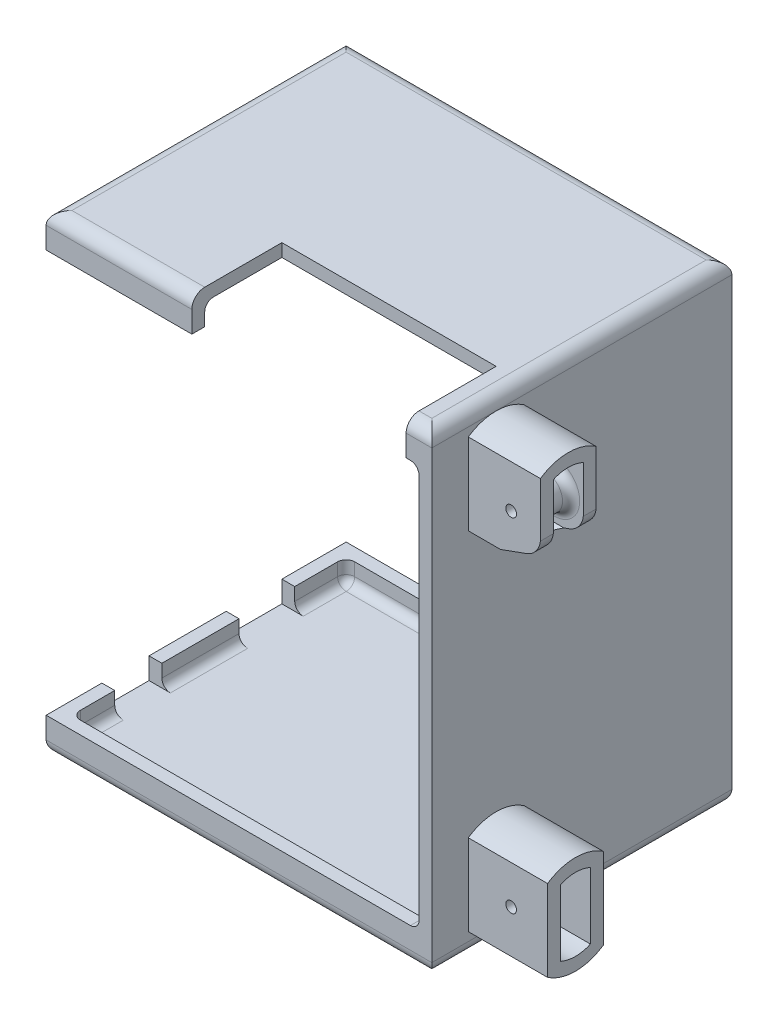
SolidWorks part; units mm, degrees
ref_plane "Plan de face" through (0, 0, 0) normal (0, 0, 1) x (1, 0, 0)
ref_plane "Plan de dessus" through (0, 0, 0) normal (0, 1, 0) x (1, 0, 0)
ref_plane "Plan de droite" through (0, 0, 0) normal (1, 0, 0) x (0, 0, -1)
sketch "Esquisse1" plane through (0, 0, 0) normal (0, 0, 1) x (1, 0, 0)
  line L0 (-3, 107) -> (-87, 107)
  line L1 (0, 0) -> (-90, 0)
  line L2 (0, 0) -> (0, 110)
  line L3 (0, 110) -> (-90, 110)
  line L4 (-90, 0) -> (-90, 20)
  line L5 (-87, 3) -> (-87, 20)
  line L6 (-3, 3) -> (-87, 3)
  line L7 (-3, 3) -> (-3, 107)
  line L8 (-90, 90) -> (-87, 90)
  line L9 (-90, 20) -> (-87, 20)
  line L10 (-87, 90) -> (-87, 107)
  line L11 (-90, 90) -> (-90, 110)
  line L12 (-87, 3) -> (-87, 107) construction
  line L14 (-90, 0) -> (-90, 110) construction
  dimension "D1" = 90
  dimension "D2" = 110
  dimension "D4" = 20
  dimension "D5" = 20
  dimension "D3" = 3
extrude "Boss.-Extru.2" add sketch "Esquisse1" along normal blind 70 contours L3 L11 L8 L10 L0 L7 L6 L5 L9 L4 L1 L2
ref_plane "Plan1" through (0, 0, 55) normal (0, 0, 1) x (1, 0, 0)
sketch "Esquisse6" plane through (-3, 0, 0) normal (-1, 0, 0) x (0, 0, 1)
  line L0 (0, 3) -> (0, 107) construction
  line L1 (70, 107) -> (67, 107)
  line L2 (70, 107) -> (70, 102)
  line L3 (70, 102) -> (67, 102)
  line L4 (67, 107) -> (67, 102)
  line L5 (0, 3) -> (3, 3)
  line L6 (0, 3) -> (0, 8)
  line L7 (0, 8) -> (3, 8)
  line L8 (3, 3) -> (3, 8)
  line L9 (70, 3) -> (0, 3) construction
  line L10 (70, 3) -> (70, 107) construction
  line L11 (0, 107) -> (3, 107)
  line L12 (0, 107) -> (0, 102)
  line L13 (0, 102) -> (3, 102)
  line L14 (3, 107) -> (3, 102)
  line L15 (70, 3) -> (67, 3)
  line L16 (70, 3) -> (70, 8)
  line L17 (70, 8) -> (67, 8)
  line L18 (67, 3) -> (67, 8)
  point P24 (1.5, 102)
  dimension "D1" = 3
  dimension "D3" = 3
  dimension "D4" = 5
extrude "Boss.-Extru.5" add sketch "Esquisse6" along normal up to next
fillet "Congé1" radius 3 8 edges at (-45, 110, 0) (-45, 110, 70) (-45, 0, 0) (-45, 0, 70) (-90, 0, 35) (-90, 110, 35) (0, 0, 35) (0, 110, 35)
sketch "Esquisse2" plane through (0, 0, 0) normal (1, 0, 0) x (0, 0, -1)
  line L0 (-58.5, 103.246) -> (-58.5, 87.754)
  line L1 (-55, 84.9462) -> (-55, 52.4993) construction
  line L2 (-61.5, 104.9868) -> (-61.5, 86.0132)
  line L3 (-70, 3) -> (-70, 107) construction
  line L4 (-48.5, 104.9868) -> (-48.5, 86.0132)
  line L5 (-70, 110) -> (0, 110) construction
  line L6 (-76.0782, 45) -> (5.983, 45) construction
  line L7 (-51.5, 103.246) -> (-51.5, 87.754)
  line L10 (-81.25, 95.5) -> (-28.75, 95.5) construction
  arc A0 (-51.5, 87.754) -> (-58.5, 87.754) centre (-55, 95.5) cw
  arc A1 (-48.5, 104.9868) -> (-61.5, 104.9868) centre (-55, 95.5) ccw
  arc A2 (-51.5, 103.246) -> (-58.5, 103.246) centre (-55, 95.5) ccw
  arc A7 (-48.5, 86.0132) -> (-61.5, 86.0132) centre (-55, 95.5) cw
  point P14 (-48.75, 57.5)
  point P16 (-61.25, 57.5)
extrude "Boss.-Extru.4" add sketch "Esquisse2" along normal blind 18.5
sketch "Esquisse4" plane through (0, 0, 55) normal (0, 0, 1) x (1, 0, 0)
  line L0 (16.8302, 92.3445) -> (16.8302, 107)
  line L1 (13.5725, 88.212) -> (2, 84)
  line L2 (0, 84) -> (18.5, 84) construction
  line L3 (2, 84) -> (18.5, 84)
  line L4 (18.5, 84) -> (18.5, 107)
  line L5 (0, 3) -> (0, 107) construction
  line L7 (18.5, 107) -> (0, 107) construction
  line L8 (16.8302, 107) -> (18.5, 107)
  arc A0 (13.5725, 88.212) -> (16.8302, 92.3445) centre (11.8624, 92.9105) ccw
  dimension "D4" = 5
  dimension "D1" = 2
  dimension "D3" = 20
extrude "Enlèv. mat.-Extru.1" cut sketch "Esquisse4" against normal through all and the other way through all
sketch "Esquisse5" plane through (0, 0, 55) normal (0, 0, 1) x (1, 0, 0)
  line L0 (16.8302, 107) -> (0, 107) construction
  line L1 (0, 3) -> (0, 107) construction
  circle A0 centre (10, 95) radius 1.25
  point P6 (0, 55)
  dimension "D1" = 2.5
  dimension "D2" = 12
  dimension "D3" = 10
extrude "Enlèv. mat.-Extru.2" cut sketch "Esquisse5" against normal through all and the other way through all
sketch "Esquisse7" plane through (0, 0, 0) normal (1, 0, 0) x (0, 0, -1)
  line L2 (-51.5, 87.754) -> (-51.5, 103.246)
  line L3 (-58.5, 103.246) -> (-58.5, 87.754)
  line L4 (-51.5, 87.754) -> (-51.5, 103.246)
  line L5 (-58.5, 103.246) -> (-58.5, 87.754)
  arc A2 (-51.5, 103.246) -> (-58.5, 103.246) centre (-55, 95.5) ccw
  arc A3 (-58.5, 87.754) -> (-51.5, 87.754) centre (-55, 95.5) ccw
  arc A4 (-51.5, 103.246) -> (-58.5, 103.246) centre (-55, 95.5) ccw
  arc A5 (-58.5, 87.754) -> (-51.5, 87.754) centre (-55, 95.5) ccw
  dimension "D1" = 0
extrude "Enlèv. mat.-Extru.3" cut sketch "Esquisse7" against normal up to next
sketch "Esquisse8" plane through (0, 0, 55) normal (0, 0, 1) x (1, 0, 0)
  circle A0 centre (10, 95) radius 4
  dimension "D1" = 8
extrude "Boss.-Extru.6" add sketch "Esquisse8" along normal up to surface and the other way up to surface
fillet "Congé3" radius 2 2 edges at (6, 95, 58.5) (14, 95, 51.5)
ref_plane "Plan2" through (0, 55, 0) normal (0, -1, 0) x (-1, 0, 0)
sketch "Esquisse9" plane through (0, 110, 0) normal (0, 1, 0) x (1, 0, 0)
  line L0 (-38.5, -55) -> (38.5, -55) construction
  line L1 (-6, -74.201) -> (-56, -74.201)
  line L2 (-6, -74.201) -> (-6, -49)
  line L3 (-6, -49) -> (-56, -49)
  line L4 (-56, -74.201) -> (-56, -49)
  line L5 (0, 0) -> (0, -55) construction
  dimension "D2" = 6
  dimension "D3" = 50
  dimension "D4" = 6
extrude "Enlèv. mat.-Extru.4" cut sketch "Esquisse9" against normal up to next contours L4 L3 L2 L1
sketch "Esquisse10" plane through (-90, 0, 0) normal (-1, 0, 0) x (0, 0, 1)
  line L0 (70, 20) -> (0, 20) construction
  line L1 (15, 20) -> (28, 20)
  line L2 (15, 20) -> (15, 3)
  line L3 (15, 3) -> (28, 3)
  line L4 (28, 20) -> (28, 3)
  line L5 (0, 3) -> (0, 20) construction
  line L6 (67, 3) -> (3, 3) construction
  line L7 (46, 20) -> (57, 20)
  line L8 (46, 20) -> (46, 3)
  line L9 (46, 3) -> (57, 3)
  line L10 (57, 20) -> (57, 3)
  dimension "D1" = 15
  dimension "D2" = 13
  dimension "D3" = 18
  dimension "D4" = 11
extrude "Enlèv. mat.-Extru.5" cut sketch "Esquisse10" against normal up to next
fillet "Congé6" radius 2 27 edges at (-4.5, 107, 67) (-71.5, 107, 67) (-87, 102, 68.5) (-87, 102, 1.5) (-87, 8, 1.5) (-87, 8, 68.5) (-87, 5.5, 67) (-87, 5.5, 3) (-3, 5.5, 67) (-3, 5.5, 3) (-87, 104.5, 67) (-87, 104.5, 3) (-3, 104.5, 3) (-3, 104.5, 67) (-87, 107, 35) (-45, 107, 3) (-3, 107, 35) (-87, 3, 62) (-45, 3, 67) (-3, 3, 35) (-45, 3, 3) (-87, 3, 9) (-87, 3, 37) (-3, 102, 1.5) (-3, 102, 68.5) (-3, 8, 68.5) (-3, 8, 1.5)
mirror "Symétrie3" about plane through (0, 55, 0) normal (0, -1, 0) of "Enlèv. mat.-Extru.2", "Boss.-Extru.4"
sketch "SAISIE GOBELETS 55-58" plane through (0, 0, 55) normal (0, 0, 1) x (1, 0, 0)
  line L0 (-23.9295, 50.1437) -> (143.1139, 50.1437) construction
  line L1 (101.4918, 20.2518) -> (86.6748, 22.5877) construction
  circle A0 centre (98.1064, 50.1437) radius 27.5 construction
  circle A1 centre (98.1064, 50.1437) radius 29 construction
  point P5 (98.611, 51.9099)
  point P6 (94.783, 51.9452)
  point P7 (98.2679, 51.1679)
  dimension "D1" = 55
  dimension "D2" = 58
sketch "Esquisse12" plane through (-90, 0, 0) normal (-1, 0, 0) x (0, 0, 1)
  line L0 (0, 90) -> (0, 107) construction
  line L1 (0, 102) -> (70, 102)
  line L2 (0, 102) -> (0, 8)
  line L3 (0, 8) -> (70, 8)
  line L4 (70, 102) -> (70, 8)
  line L5 (70, 10) -> (70, 100) construction
  line L6 (70, 102) -> (67, 102) construction
  line L7 (67, 8) -> (70, 8) construction
extrude "Enlèv. mat.-Extru.7" cut sketch "Esquisse12" against normal blind 10
equation "\"D4@Esquisse2\"=\"D2@Esquisse2\"/2"
